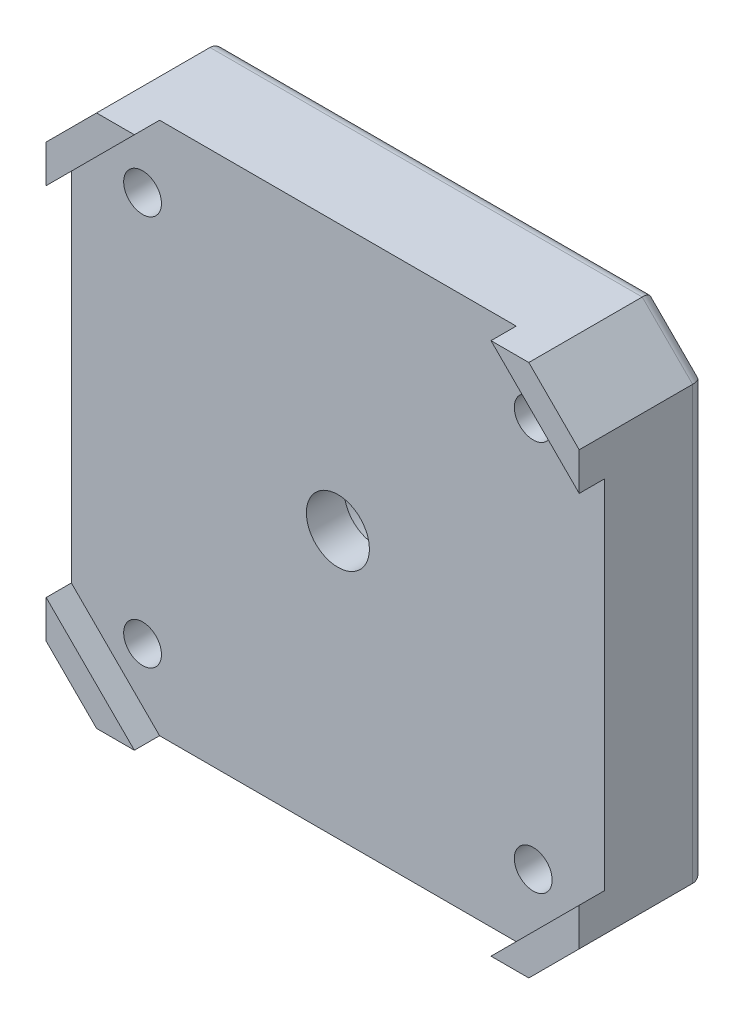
SolidWorks part; units mm, degrees
ref_plane "Plan de face" through (0, 0, 0) normal (0, 0, 1) x (1, 0, 0)
ref_plane "Plan de dessus" through (0, 0, 0) normal (0, 1, 0) x (1, 0, 0)
ref_plane "Plan de droite" through (0, 0, 0) normal (1, 0, 0) x (0, 0, -1)
sketch "Esquisse1" plane through (0, 0, 0) normal (0, 0, 1) x (1, 0, 0)
  line L0 (-21.15, 17.15) -> (-17.15, 21.15)
  line L1 (-17.15, 21.15) -> (17.15, 21.15)
  line L2 (-21.15, 17.15) -> (-21.15, -17.15)
  line L3 (-17.15, -21.15) -> (17.15, -21.15)
  line L4 (21.15, 17.15) -> (21.15, -17.15)
  line L5 (-21.15, 21.15) -> (21.15, -21.15) construction
  line L6 (-21.15, -21.15) -> (21.15, 21.15) construction
  line L7 (17.15, 21.15) -> (21.15, 17.15)
  line L8 (21.15, -17.15) -> (17.15, -21.15)
  line L9 (-21.15, -17.15) -> (-17.15, -21.15)
  point P0 (0, 0)
  dimension "D1" = 42.3
extrude "Boss.-Extru.1" add sketch "Esquisse1" along normal blind 10
sketch "Esquisse2" plane through (0, 0, 10) normal (0, 0, 1) x (1, 0, 0)
  line L0 (14.15, 21.15) -> (21.15, 14.15)
  line L1 (-14.15, 21.15) -> (14.15, 21.15)
  line L2 (-21.15, 14.15) -> (-21.15, -14.15)
  line L3 (-14.15, -21.15) -> (14.15, -21.15)
  line L4 (21.15, 14.15) -> (21.15, -14.15)
  line L5 (-21.15, 21.15) -> (21.15, -21.15) construction
  line L6 (-21.15, -21.15) -> (21.15, 21.15) construction
  line L7 (21.15, -14.15) -> (14.15, -21.15)
  line L8 (-21.15, -14.15) -> (-14.15, -21.15)
  line L9 (-14.15, 21.15) -> (-21.15, 14.15)
  point P0 (0, 0)
  dimension "D1" = 42.3
extrude "Enlèv. mat.-Extru.1" cut sketch "Esquisse2" against normal blind 2
sketch "Esquisse3" plane through (0, 0, 8) normal (0, 0, 1) x (1, 0, 0)
  line L1 (-15.5, 15.5) -> (15.5, 15.5) construction
  line L2 (-15.5, 15.5) -> (-15.5, -15.5) construction
  line L3 (-15.5, -15.5) -> (15.5, -15.5) construction
  line L4 (15.5, 15.5) -> (15.5, -15.5) construction
  line L5 (-15.5, 15.5) -> (15.5, -15.5) construction
  line L6 (-15.5, -15.5) -> (15.5, 15.5) construction
  circle A0 centre (-15.5, 15.5) radius 1.5
  circle A1 centre (15.5, 15.5) radius 1.5
  circle A2 centre (15.5, -15.5) radius 1.5
  circle A3 centre (-15.5, -15.5) radius 1.5
  point P0 (0, 0)
  dimension "D2" = 3
  dimension "D1" = 31
extrude "Enlèv. mat.-Extru.2" cut sketch "Esquisse3" against normal through all
sketch "Esquisse4" plane through (0, 0, 0) normal (0, 0, -1) x (-1, 0, 0)
  line L1 (-15.5, -15.5) -> (15.5, -15.5) construction
  line L2 (-15.5, -15.5) -> (-15.5, 15.5) construction
  line L3 (-15.5, 15.5) -> (15.5, 15.5) construction
  line L4 (15.5, -15.5) -> (15.5, 15.5) construction
  circle A0 centre (-15.5, 15.5) radius 3.1
  circle A1 centre (15.5, 15.5) radius 3.1
  circle A2 centre (15.5, -15.5) radius 3.1
  circle A3 centre (-15.5, -15.5) radius 3.1
  point P0 (0, 0)
  dimension "D1" = 6.2
extrude "Enlèv. mat.-Extru.3" cut sketch "Esquisse4" against normal blind 3
fillet "Congé1" radius 0.5 8 edges at (-18.6, -15.5, 0) (-18.6, -15.5, 3) (12.4, -15.5, 0) (12.4, -15.5, 3) (-18.6, 15.5, 0) (-18.6, 15.5, 3) (12.4, 15.5, 0) (12.4, 15.5, 3)
fillet "Congé2" radius 1 8 edges at (-19.15, 19.15, 0) (-21.15, 0, 0) (-19.15, -19.15, 0) (0, -21.15, 0) (19.15, -19.15, 0) (21.15, 0, 0) (19.15, 19.15, 0) (0, 21.15, 0)
sketch "Esquisse5" plane through (0, 0, 0) normal (0, 0, -1) x (-1, 0, 0)
  circle A0 centre (0, 0) radius 5.5
  dimension "D1" = 11
extrude "Enlèv. mat.-Extru.4" cut sketch "Esquisse5" against normal blind 5
sketch "Esquisse6" plane through (0, 0, 5) normal (0, 0, -1) x (-1, 0, 0)
  circle A0 centre (0, 0) radius 2.5
  dimension "D1" = 5
extrude "Enlèv. mat.-Extru.5" cut sketch "Esquisse6" against normal through all
fillet "Congé3" radius 0.5 2 edges at (-5.5, 0, 0) (-5.5, 0, 5)
